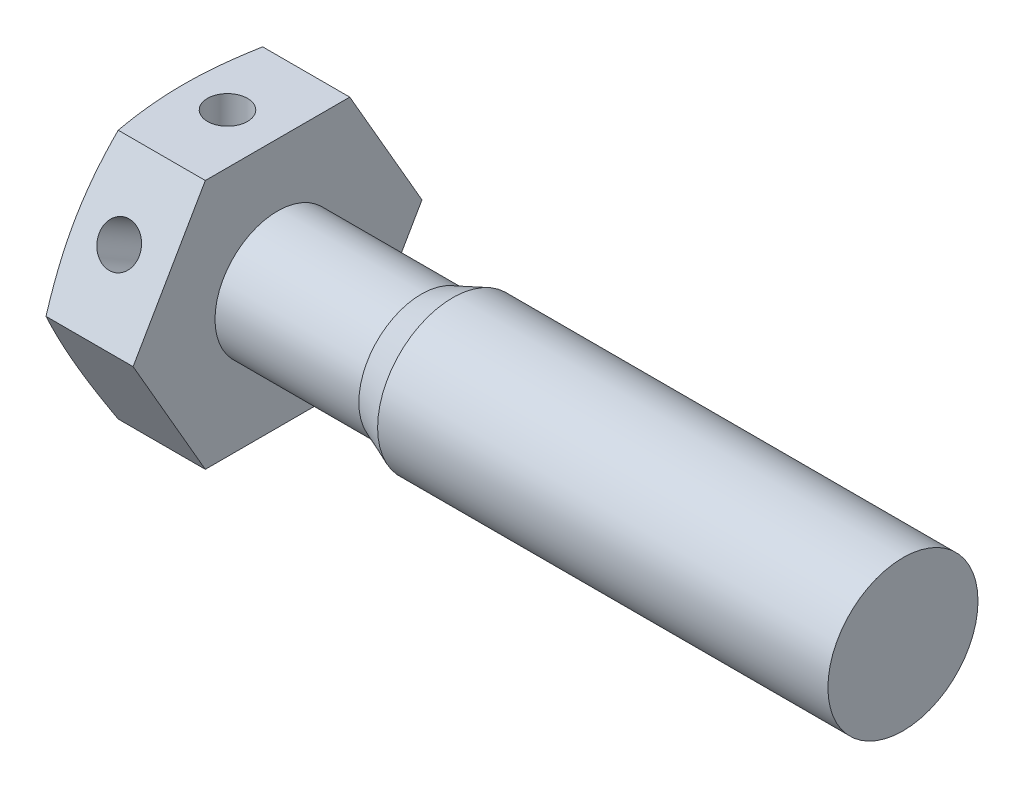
SolidWorks part; units mm, degrees
ref_plane "Front" through (0, 0, 0) normal (0, 0, 1) x (1, 0, 0)
ref_plane "Top" through (0, 0, 0) normal (0, 1, 0) x (1, 0, 0)
ref_plane "Right" through (0, 0, 0) normal (1, 0, 0) x (0, 0, -1)
sketch "Sketch1" plane through (0, 0, 0) normal (1, 0, 0) x (0, 0, -1)
  line L1 (5.7735, 0) -> (2.8868, 5)
  line L2 (2.8868, 5) -> (-2.8868, 5)
  line L3 (-2.8868, 5) -> (-5.7735, 0)
  line L4 (-5.7735, 0) -> (-2.8868, -5)
  line L5 (-2.8868, -5) -> (2.8868, -5)
  line L6 (2.8868, -5) -> (5.7735, 0)
  circle A0 centre (0, 0) radius 5 construction
  dimension "s" = 10
extrude "BaseHead" add sketch "Sketch1" along normal blind 4
ref_plane "Plane1" through (11, 0, 0) normal (1, 0, 0) x (0, 0, -1)
sketch "Sketch2" plane through (4, 0, 0) normal (1, 0, 0) x (0, 0, -1)
  circle A0 centre (0, 0) radius 3
  dimension "d" = 6
extrude "BaseBody" add sketch "Sketch2" along normal blind 25
sketch "Sketch3" plane through (3.1612, 0, 2.6123) normal (0, 1, 0) x (0, 0, -1)
  line L0 (2.6123, 5.2326) -> (2.6123, 1.6388) construction
  line L2 (8.3858, 3.1612) -> (8.3858, 2.6431)
  line L3 (8.3858, 2.6431) -> (6.9623, 3.1612)
  line L5 (6.9623, 3.1612) -> (8.3858, 3.1612)
  dimension "D1" = 20
  dimension "dw" = 8.7
revolve "HeadChamfer" cut sketch "Sketch3" angle 360 about L0
sketch "Sketch4" plane through (0, 0, 0) normal (-1, 0, 0) x (0, 0, 1)
  circle A0 centre (0, 0) radius 3.4
  dimension "da" = 6.8
extrude "Cut-Extrude1" cut sketch "Sketch4" against normal blind 0.8
sketch "Sketch5" plane through (-2.9296, 0, 7.9296) normal (0, 1, 0) x (0, 0, -1)
  line L0 (7.9296, -0.2325) -> (7.9296, -16.4861) construction
  line L1 (7.9296, -31.9296) -> (7.9296, -6.9296) construction
  line L2 (10.9296, -13.9296) -> (10.4296, -12.6796)
  line L3 (4.9296, -31.9296) -> (10.9296, -31.9296) construction
  line L4 (10.4296, -12.6796) -> (10.4296, -6.9296)
  line L5 (10.9296, -31.9296) -> (10.9296, -6.9296) construction
  line L6 (10.4296, -6.9296) -> (12.9296, -6.9296)
  line L7 (12.9296, -6.9296) -> (12.9296, -13.9296)
  line L8 (12.9296, -13.9296) -> (10.9296, -13.9296)
  line L9 (13.7031, -6.9296) -> (10.8164, -6.9296) construction
  dimension "ds" = 5
  dimension "x" = 1.25
  dimension "D3" = 18
  dimension "D4" = 10
revolve "Cut-Revolve1" cut sketch "Sketch5" angle 360 about L0
fillet "HeadFillet" [suppressed] radius 0.25
sketch "Sketch6" plane through (0, 0, 0) normal (0, 1, 0) x (1, 0, 0)
  line L0 (-2.6972, 0) -> (13.5564, 0) construction
  line L1 (4, 5.7735) -> (4, 2.8868) construction
  circle A0 centre (2, 0) radius 0.8
  dimension "d1" = 1.6
  dimension "h" = 2
extrude "Hole" cut sketch "Sketch6" against normal through all and the other way through all
pattern_circular "CirPattern1" count 2 over 60 about axis through (-2.6972, 0, 0) along (1, 0, 0) of "Hole"
sketch "Sketch7" plane through (0, 0, 0) normal (0, 0, 1) x (1, 0, 0)
  line L0 (28.7293, 3.2) -> (29.2707, 3.2)
  line L1 (29.2707, 3.2) -> (29.2708, 3)
  line L2 (29.2708, 3) -> (29, 2.531)
  line L3 (28.7293, 3) -> (29, 2.531)
  line L4 (28.7293, 3.2) -> (28.7293, 3)
  line L5 (28.8635, 0) -> (0, 0) construction
  line L6 (28.7293, 3) -> (29.2708, 3) construction
  line L7 (29, 3) -> (29, 2.531) construction
  line L8 (29, -3) -> (29, 3) construction
  line L9 (29, 3) -> (11, 3) construction
  point P5 (29, 3.2)
  dimension "D1" = 0.2
  dimension "D2" = 0.5415
revolve "Cut-Revolve10" [suppressed] cut sketch "Sketch7" angle 360 about L5
pattern_linear "LPattern10" [suppressed] count 28 spacing 0.6498 along (1, 0, 0)
equation "\"D1@Cut-Extrude1\" = 0.2 * \"k@BaseHead\""
equation "\"b@ThreadCosmetic1\" = \"l@BaseBody\" - \"lg@Plane1\""
equation "\"D4@Sketch5\" = 2 * \"ds@Sketch5\""
equation "\"D3@Sketch5\" =\"l@BaseBody\" - \"lg@Plane1\""
equation "\"D2@Sketch7\" =  ( \"d@Sketch2\" - \"D2@ThreadCosmetic1\" )  / 2"
equation "\"D3@LPattern10\" = \"D2@Sketch7\" * 1.2"
equation "\"D1@LPattern10\" = \"b@ThreadCosmetic1\" / \"D3@LPattern10\""
